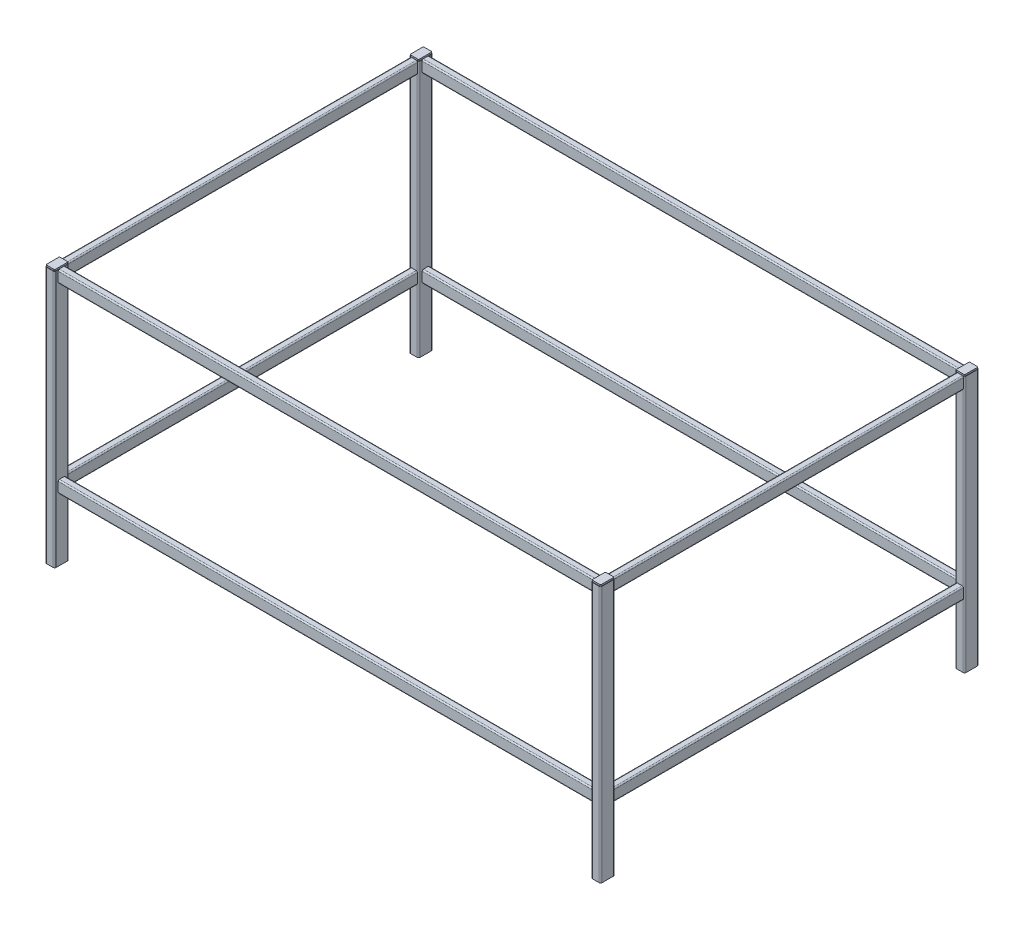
SolidWorks part; units mm, degrees
ref_plane "Default Plane" through (-894.4, 25, 586) normal (-1, 0, 0) x (0, 0, 1)
sketch3d "Bounding-Box_Columns"
  line L0 (53.6, 0, 0) -> (53.6, -939.4, 0) construction
  line L1 (53.6, -939.4, 0) -> (-6.4, -939.4, 0) construction
  line L2 (-6.4, -939.4, 0) -> (-6.4, 0, 0) construction
  line L3 (-6.4, 0, 0) -> (53.6, 0, 0) construction
  line L4 (53.6, 0, 40) -> (53.6, -939.4, 40) construction
  line L5 (53.6, -939.4, 40) -> (-6.4, -939.4, 40) construction
  line L6 (-6.4, -939.4, 40) -> (-6.4, 0, 40) construction
  line L7 (-6.4, 0, 40) -> (53.6, 0, 40) construction
  line L8 (53.6, 0, 0) -> (53.6, 0, 40) construction
  line L9 (53.6, -939.4, 0) -> (53.6, -939.4, 40) construction
  line L10 (-6.4, -939.4, 0) -> (-6.4, -939.4, 40) construction
  line L11 (-6.4, 0, 0) -> (-6.4, 0, 40) construction
ref_plane "Default Plane" through (-899.4, 19.8, -579.755) normal (-1, 0, 0) x (0, 0, 1)
sketch3d "Bounding-Box_Beams"
  line L0 (0, -44.8, 0) -> (1159.51, -44.8, 0) construction
  line L1 (1159.51, -44.8, 0) -> (1159.51, 5.2, 0) construction
  line L2 (1159.51, 5.2, 0) -> (0, 5.2, 0) construction
  line L3 (0, 5.2, 0) -> (0, -44.8, 0) construction
  line L4 (0, -44.8, 30) -> (1159.51, -44.8, 30) construction
  line L5 (1159.51, -44.8, 30) -> (1159.51, 5.2, 30) construction
  line L6 (1159.51, 5.2, 30) -> (0, 5.2, 30) construction
  line L7 (0, 5.2, 30) -> (0, -44.8, 30) construction
  line L8 (0, -44.8, 0) -> (0, -44.8, 30) construction
  line L9 (1159.51, -44.8, 0) -> (1159.51, -44.8, 30) construction
  line L10 (1159.51, 5.2, 0) -> (1159.51, 5.2, 30) construction
  line L11 (0, 5.2, 0) -> (0, 5.2, 30) construction
ref_plane "Default Plane" through (-1031.6, -1050, 701.4) normal (0, -1, 0) x (-1, 0, 0)
sketch3d "Bounding-Box_ENDCAPS"
  line L0 (36.8, -2, 0) -> (36.8, 54.8, 0) construction
  line L1 (36.8, 54.8, 0) -> (0, 54.8, 0) construction
  line L2 (0, 54.8, 0) -> (0, -2, 0) construction
  line L3 (0, -2, 0) -> (36.8, -2, 0) construction
  line L4 (36.8, -2, 5) -> (36.8, 54.8, 5) construction
  line L5 (36.8, 54.8, 5) -> (0, 54.8, 5) construction
  line L6 (0, 54.8, 5) -> (0, -2, 5) construction
  line L7 (0, -2, 5) -> (36.8, -2, 5) construction
  line L8 (36.8, -2, 0) -> (36.8, -2, 5) construction
  line L9 (36.8, 54.8, 0) -> (36.8, 54.8, 5) construction
  line L10 (0, 54.8, 0) -> (0, 54.8, 5) construction
  line L11 (0, -2, 0) -> (0, -2, 5) construction
ref_plane "Front Plane" through (0, 0, 0) normal (0, 0, 1) x (1, 0, 0)
ref_plane "Top Plane" through (0, 0, 0) normal (0, 1, 0) x (1, 0, 0)
ref_plane "Right Plane" through (0, 0, 0) normal (1, 0, 0) x (0, 0, -1)
sketch "Sketch2" plane through (0, 0, 0) normal (0, 1, 0) x (1, 0, 0)
  line L1 (1143, 762) -> (-1143, 762)
  line L2 (1143, 762) -> (1143, -762)
  line L3 (1143, -762) -> (-1143, -762)
  line L4 (-1143, 762) -> (-1143, -762)
  line L5 (1143, 762) -> (-1143, -762) construction
  line L6 (1143, -762) -> (-1143, 762) construction
  point P0 (0, 0)
  dimension "D1" = 2286
  dimension "D2" = 1524
surface "Surface 1" sketch "Sketch2"
surface "Surface 2" parameters "D1"=762
sketch3d "3DSketch1"
  line L0 (-1143, 0, 762) -> (-1143, -1050, 762)
  line L1 (1143, 0, 762) -> (1143, -1050, 762)
  line L2 (1143, 0, -762) -> (1143, -1050, -762)
  line L3 (-1143, 0, -762) -> (-1143, -1050, -762)
  dimension "D1" = 1050
other "Structure System1"
sketch3d "Structure System Grid2"
  line L0 (-1143, 0, 762) -> (-1143, -1050, 762)
  line L1 (1143, 0, 762) -> (1143, -1050, 762)
  line L2 (1143, 0, -762) -> (1143, -1050, -762)
  line L3 (-1143, 0, -762) -> (-1143, -1050, -762)
  line L4 (-1143, 0, 762) -> (-1143, 0, -762)
  line L5 (-1143, -762, 762) -> (-1143, -762, -762)
  line L6 (-1143, 0, -762) -> (1143, 0, -762)
  line L7 (-1143, -762, -762) -> (1143, -762, -762)
  line L8 (1143, 0, -762) -> (1143, 0, 762)
  line L9 (1143, -762, -762) -> (1143, -762, 762)
  line L10 (1143, 0, 762) -> (-1143, 0, 762)
  line L11 (1143, -762, 762) -> (-1143, -762, 762)
other "<ISO><rectangular tube><60 x 40 x 3.2>(1)"
ref_plane "Plane2" through (-1143, 0, 762) normal (0, -1, 0) x (1, 0, 0)
sketch "Sketch1" plane through (-1143, 0, 762) normal (0, -1, 0) x (1, 0, 0)
  line L0 (-13.6, -26.8) -> (13.6, -26.8)
  line L1 (-16.8, -23.6) -> (-16.8, 23.6)
  line L2 (13.6, 26.8) -> (-13.6, 26.8)
  line L3 (16.8, 23.6) -> (16.8, -23.6)
  line L4 (-13.6, -30) -> (13.6, -30)
  line L5 (-20, -23.6) -> (-20, 23.6)
  line L6 (13.6, 30) -> (-13.6, 30)
  line L7 (20, 23.6) -> (20, -23.6)
  arc A0 (20, 23.6) -> (13.6, 30) centre (13.6, 23.6) ccw
  arc A1 (13.6, -30) -> (20, -23.6) centre (13.6, -23.6) ccw
  arc A2 (-20, -23.6) -> (-13.6, -30) centre (-13.6, -23.6) ccw
  arc A3 (-13.6, 30) -> (-20, 23.6) centre (-13.6, 23.6) ccw
  arc A4 (-13.6, 26.8) -> (-16.8, 23.6) centre (-13.6, 23.6) ccw
  arc A5 (16.8, 23.6) -> (13.6, 26.8) centre (13.6, 23.6) ccw
  arc A6 (13.6, -26.8) -> (16.8, -23.6) centre (13.6, -23.6) ccw
  arc A7 (-16.8, -23.6) -> (-13.6, -26.8) centre (-13.6, -23.6) ccw
  point P0 (0, 30)
  point P1 (20, 0)
  point P2 (0, -30)
  point P3 (-20, 0)
  point P4 (-20, 30)
  point P5 (20, 30)
  point P6 (20, -30)
  point P7 (-20, -30)
  point P8 (0, 0)
  point P33 (0, 0)
  dimension "D1" = 6.4
  dimension "Thickness" = 3.2
  dimension "V_leg" = 60
  dimension "H_leg" = 40
other "Member1"
other "Member2"
other "Member3"
other "Member4"
other "<ISO><rectangular tube><50 x 30 x 2.6>(1)"
ref_plane "Plane3" through (-1143, 0, 762) normal (0, 0, -1) x (-1, 0, 0)
sketch "Sketch11" plane through (-1143, 0, 762) normal (0, 0, -1) x (-1, 0, 0)
  line L0 (-9.8, -22.4) -> (9.8, -22.4)
  line L1 (-12.4, -19.8) -> (-12.4, 19.8)
  line L2 (9.8, 22.4) -> (-9.8, 22.4)
  line L3 (12.4, 19.8) -> (12.4, -19.8)
  line L4 (-9.8, -25) -> (9.8, -25)
  line L5 (-15, -19.8) -> (-15, 19.8)
  line L6 (9.8, 25) -> (-9.8, 25)
  line L7 (15, 19.8) -> (15, -19.8)
  arc A0 (15, 19.8) -> (9.8, 25) centre (9.8, 19.8) ccw
  arc A1 (9.8, -25) -> (15, -19.8) centre (9.8, -19.8) ccw
  arc A2 (-15, -19.8) -> (-9.8, -25) centre (-9.8, -19.8) ccw
  arc A3 (-9.8, 25) -> (-15, 19.8) centre (-9.8, 19.8) ccw
  arc A4 (-9.8, 22.4) -> (-12.4, 19.8) centre (-9.8, 19.8) ccw
  arc A5 (12.4, 19.8) -> (9.8, 22.4) centre (9.8, 19.8) ccw
  arc A6 (9.8, -22.4) -> (12.4, -19.8) centre (9.8, -19.8) ccw
  arc A7 (-12.4, -19.8) -> (-9.8, -22.4) centre (-9.8, -19.8) ccw
  point P0 (0, 25)
  point P1 (15, 0)
  point P2 (0, -25)
  point P3 (-15, 0)
  point P4 (-15, 25)
  point P5 (15, 25)
  point P6 (15, -25)
  point P7 (-15, -25)
  point P8 (0, 0)
  point P33 (0, 0)
  dimension "D1" = 5.2
  dimension "Thickness" = 2.6
  dimension "V_leg" = 50
  dimension "H_leg" = 30
other "Member5"
other "Member6"
other "Member7"
other "Member8"
other "Member9"
other "Member10"
other "Member11"
other "Member12"
other "Corner Management1"
other "Complex Corner Group1"
other "Corner Group1"
other "Corner1"
other "Corner2"
other "Corner3"
other "Corner6"
other "Corner Group2"
other "Corner4"
other "Corner5"
other "Corner7"
other "Corner8"
other "End cap1" parameters "D1"=6.35, "D2"=3.175, "D3"=3.175, "D4"=0
